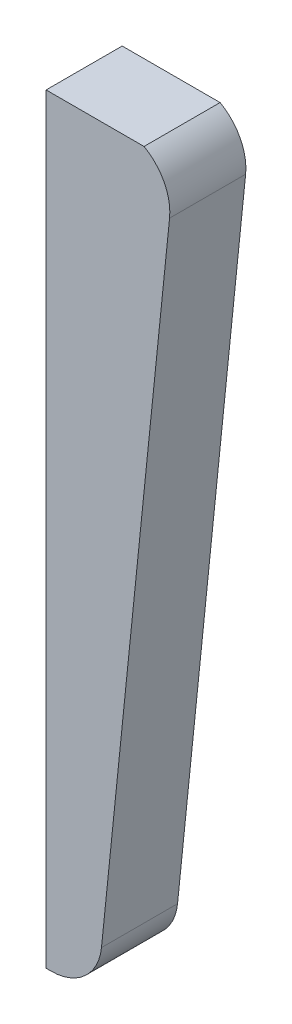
SolidWorks part; units mm, degrees
ref_plane "Plan de face" through (0, 0, 0) normal (0, 0, 1) x (1, 0, 0)
ref_plane "Plan de dessus" through (0, 0, 0) normal (0, 1, 0) x (1, 0, 0)
ref_plane "Plan de droite" through (0, 0, 0) normal (1, 0, 0) x (0, 0, -1)
sketch "Esquisse1" plane through (0, 0, 0) normal (0, 0, 1) x (1, 0, 0)
  line L1 (-0.5549, -2.3486) -> (3.3073, -2.3486)
  line L2 (-0.5549, -2.3486) -> (-0.5549, -32.3486)
  line L3 (-0.5549, -32.3486) -> (-0.3608, -32.3486)
  line L5 (1.6288, -30.5521) -> (4.3141, -4.294)
  arc A0 (4.3141, -4.294) -> (3.3073, -2.3486) centre (2.3245, -4.0905) ccw
  arc A1 (-0.3608, -32.3486) -> (1.6288, -30.5521) centre (-0.3608, -30.3486) ccw
  point P8 (3.4451, -2.3486)
  point P11 (1.4451, -32.3486)
  dimension "D4" = 2
  dimension "D1" = 2
  dimension "D2" = 30
  dimension "D3" = 4
extrude "Boss.-Extru.1" add sketch "Esquisse1" along normal blind 3
